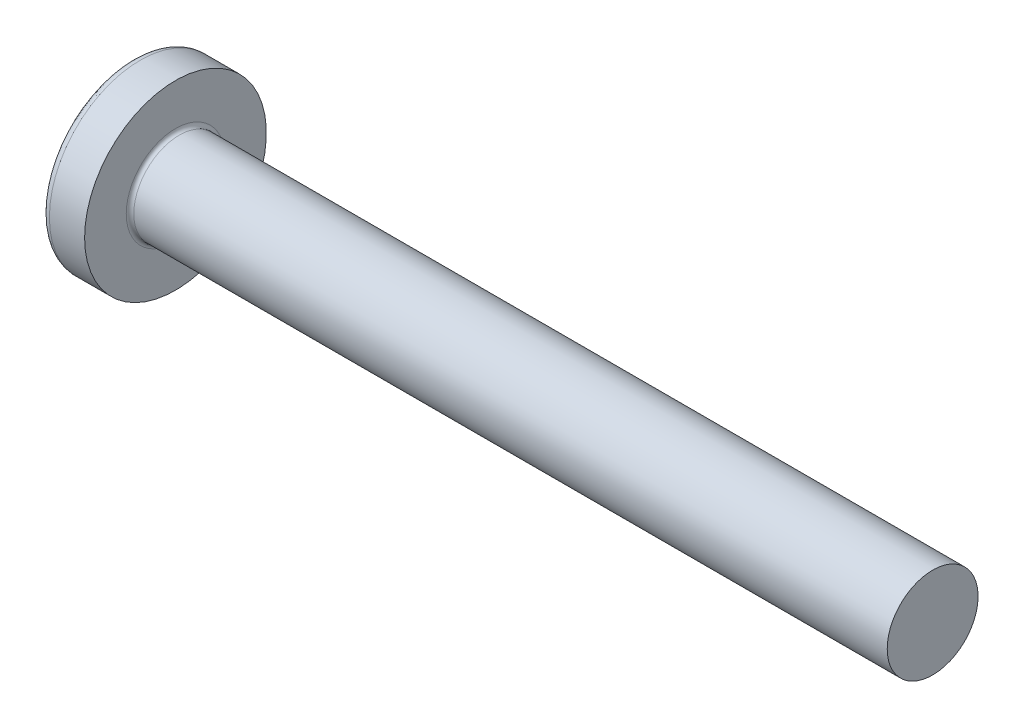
SolidWorks part; units mm, degrees
ref_plane "Plane1" through (0, 0, 0) normal (0, 0, 1) x (1, 0, 0)
ref_plane "Plane2" through (0, 0, 0) normal (0, 1, 0) x (1, 0, 0)
ref_plane "Plane3" through (0, 0, 0) normal (1, 0, 0) x (0, 0, -1)
sketch "BodySke" plane through (0, 0, 0) normal (0, 0, 1) x (1, 0, 0)
  line L0 (4.6, 3) -> (4.6, 6)
  line L1 (5.1, 6.35) -> (5.1, -3.175) construction
  line L2 (-25.4, 0) -> (127, 0) construction
  line L3 (54.6, 0) -> (0, 0)
  line L4 (4.6, 3) -> (54.6, 3)
  line L5 (54.6, 3) -> (54.6, 0)
  line L6 (2.2747, 6) -> (4.6, 6)
  line L8 (16.6, 6.35) -> (16.6, -3.175) construction
  arc A0 (1.8337, 5.7717) -> (0, 0) centre (10, 0) ccw
  arc A2 (1.8337, 5.7717) -> (2.2747, 6) centre (2.2747, 5.46) cw
revolve "Base-Revolve" add sketch "BodySke"
fillet "Fillet1" radius 0.25 1 edges at (4.6, 0, 3)
sketch "Sketch3" plane through (0, 0, 0) normal (1, 0, 0) x (0, 0, -1)
  line L0 (0.71, -3.35) -> (-0.71, -3.35)
  line L1 (0.71, -3.35) -> (0.71, 3.35)
  line L2 (-0.71, 3.35) -> (0.71, 3.35)
  line L3 (-0.71, 3.35) -> (-0.71, -3.35)
ref_plane "Plane4" through (3.46, 0, 0) normal (1, 0, 0) x (0, 0, -1)
sketch "Sketch4" plane through (3.46, 0, 0) normal (1, 0, 0) x (0, 0, -1)
  line L0 (0.71, -1.6249) -> (-0.71, -1.6249)
  line L1 (0.71, -1.6249) -> (0.71, 1.6249)
  line L2 (-0.71, 1.6249) -> (0.71, 1.6249)
  line L3 (-0.71, 1.6249) -> (-0.71, -1.6249)
loft "Recess" cut profiles "Sketch3", "Sketch4"
pattern_circular "RecPat" count 2 every 90 about axis through (0, 0, 0) along (1, 0, 0) of "Recess"
sketch "RecCorSke" plane through (0, 0, 0) normal (0, 0, 1) x (1, 0, 0)
  line L0 (-3.175, 0) -> (15.875, 0) construction
  line L1 (-25.4, 0) -> (127, 0) construction
  line L2 (0, 0) -> (0, 1.5224)
  line L3 (0, 1.5224) -> (3.46, 1.2805)
  line L4 (3.46, 1.2805) -> (3.8761, 0)
  line L5 (3.8761, 0) -> (0, 0)
revolve "RecessCore" cut sketch "RecCorSke" angle 360 about L0
sketch "ThdSchSke" plane through (0, 0, 0) normal (0, 0, 1) x (1, 0, 0)
  line L0 (16.6, -2.4455) -> (16.2117, -3)
  line L1 (16.6, -2.4455) -> (16.9883, -3)
  line L2 (16.9883, -3) -> (16.9883, -3.75)
  line L3 (-3.175, 0) -> (5.1513, 0) construction
  line L5 (16.9883, -3.75) -> (16.2117, -3.75)
  line L6 (16.2117, -3.75) -> (16.2117, -3)
revolve "ThreadSchematic" [suppressed] cut sketch "ThdSchSke" angle 360 about L3
pattern_linear "ThdSchPat" [suppressed]
equation "\"D1@Sketch3\" = \"Cross_dia@Sketch3\" / 2"
equation "\"D2@Sketch3\" = \"Cross_width@Sketch3\" / 2"
equation "\"Depth@RecCorSke\" = \"Cross_depth@Plane4\""
equation "\"D1@Sketch4\" = \"Cross_width@Sketch3\""
equation "\"D2@Sketch4\" = \"Cross_dia@Sketch3\" - 2.0 * \"Cross_depth@Plane4\" * tan(26.5  * 0.017453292)"
equation "\"D3@Sketch4\" = \"D1@Sketch4\" / 2"
equation "\"D4@Sketch4\" = \"D2@Sketch4\" / 2"
equation "\"Thread_length@ThreadCosmetic\" = ((sgn( (\"Length@BodySke\" - \"Advance@BodySke\" * 2.0 ) - \"Thread_nom@BodySke\" )-1)*( (\"Length@BodySke\" - \"Advance@BodySke\" * 2.0 ) - \"Thread_nom@BodySke\" ))/-2+ \"Thread_"
equation "\"Thread_minor@ThdSchSke\" = \"Thread_minor@ThreadCosmetic\""
equation "\"Diameter@ThdSchSke\" = \"Diameter@BodySke\""
equation "\"Overcut@ThdSchSke\" = \"Diameter@BodySke\" * 1.25"
equation "\"Start@ThdSchSke\" = \"Head_ht@BodySke\" + \"Length@BodySke\" - \"Thread_length@ThreadCosmetic\"  '---Non-countersunk---"
equation "\"Num_threads@ThdSchPat\" = int( \"Thread_length@ThreadCosmetic\" / \"Advance@BodySke\" + 0.999 )  + 1"
equation "\"Advance@ThdSchPat\" = \"Thread_length@ThreadCosmetic\" /  (\"Num_threads@ThdSchPat\" - 1) 'relax it"
